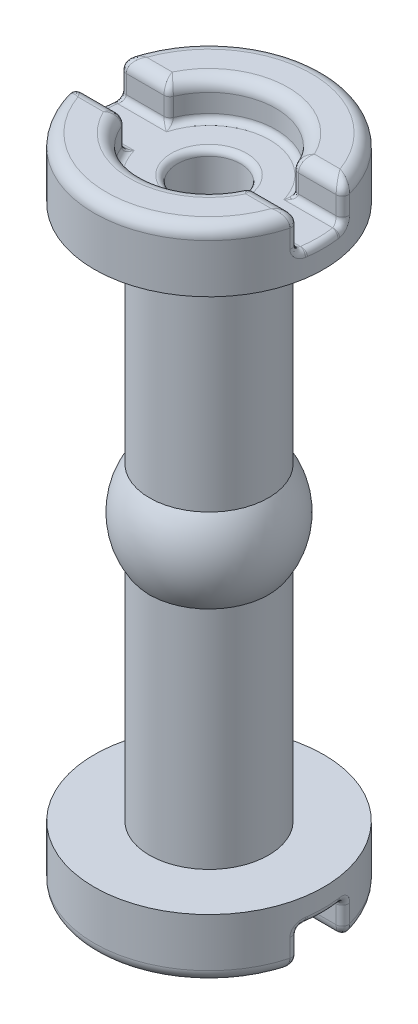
SolidWorks part; units mm, degrees
ref_plane "Plan de face" through (0, 0, 0) normal (0, 0, 1) x (1, 0, 0)
ref_plane "Plan de dessus" through (0, 0, 0) normal (0, 1, 0) x (1, 0, 0)
ref_plane "Plan de droite" through (0, 0, 0) normal (1, 0, 0) x (0, 0, -1)
imported_body "Importée1"
ref_plane "Plan1" through (-702.267, 0, 0) normal (1, 0, 0) x (0, 1, 0)
sketch "Esquisse1" plane through (-702.267, 0, -702.267) normal (1, 0, 0) x (0, 0, -1)
  line L0 (-2502.9972, -44) -> (-2502.9972, 44) construction
  line L3 (-2502.9972, 0) -> (-639.7503, 0) construction
  line L4 (-2502.9972, 12) -> (-2502.9972, -12)
  line L5 (-2521.8782, 44) -> (-2484.1162, 44) construction
  line L6 (-2484.1162, -44) -> (-2521.8782, -44) construction
  line L7 (-2502.9972, 45.0637) -> (-2502.9972, 68.8726) construction
  arc A0 (-2502.9972, -12) -> (-2502.9972, 12) centre (-2502.9972, 0) ccw
  dimension "D1" = 12
revolve "Révolution1" add sketch "Esquisse1" angle 360 about L0
